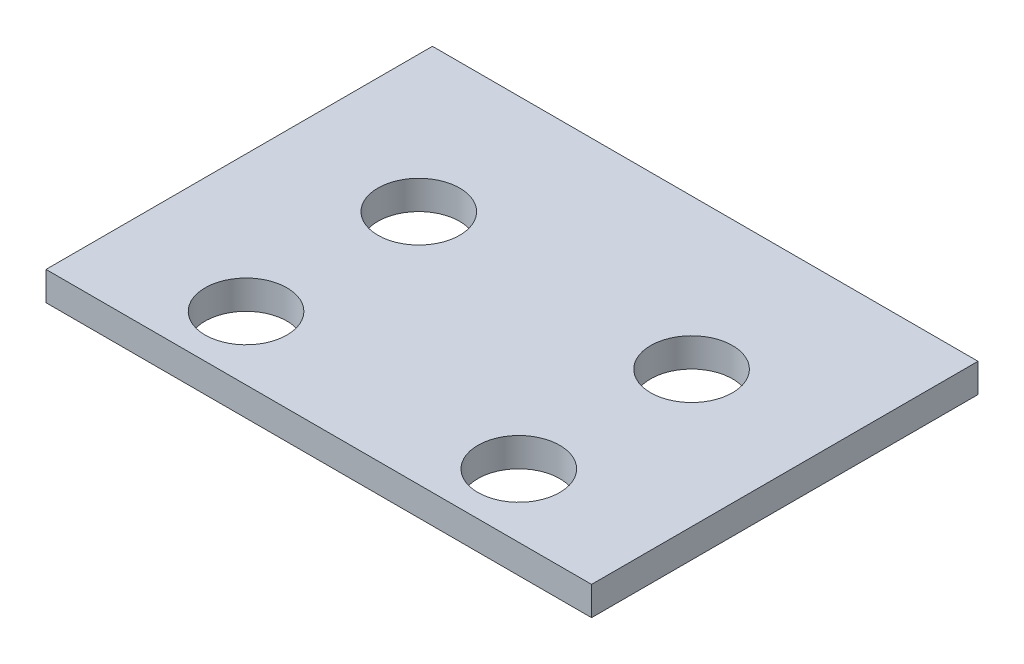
SolidWorks part; units mm, degrees
ref_plane "Front Plane" through (0, 0, 0) normal (0, 0, 1) x (1, 0, 0)
ref_plane "Top Plane" through (0, 0, 0) normal (0, 1, 0) x (1, 0, 0)
ref_plane "Right Plane" through (0, 0, 0) normal (1, 0, 0) x (0, 0, -1)
sketch "Sketch1" plane through (0, 0, 0) normal (0, 1, 0) x (1, 0, 0)
  line L1 (-30, 21.25) -> (30, 21.25)
  line L2 (-30, 21.25) -> (-30, -21.25)
  line L3 (-30, -21.25) -> (30, -21.25)
  line L4 (30, 21.25) -> (30, -21.25)
  line L5 (-30, 21.25) -> (30, -21.25) construction
  line L6 (-30, -21.25) -> (30, 21.25) construction
  point P0 (0, 0)
  dimension "D1" = 60
  dimension "D2" = 42.5
extrude "Extrude1" add sketch "Sketch1" along normal blind 3.175
sketch "Sketch13" plane through (0, 3.175, 0) normal (0, 1, 0) x (1, 0, 0)
  line L0 (-15, -7.4946) -> (-15, -31.5784) construction
  line L1 (-32.8805, -14.25) -> (-8.6861, -14.25) construction
  line L2 (-30, -21.25) -> (30, -21.25) construction
  dimension "D1" = 7
  dimension "D2" = 15
hole_wizard "M8 Clearance Hole4" positions "3DSketch10" profile "Sketch14" hole size "M8" standard "ISO"
sketch3d "3DSketch10"
  line L0 (-15, 3.175, 7.4946) -> (-15, 3.175, 31.5784) construction
  line L1 (-32.8805, 3.175, 14.25) -> (-8.6861, 3.175, 14.25) construction
  point P0 (-15, 3.175, 14.25)
sketch "Sketch14" plane through (-15, 3.175, 14.25) normal (1, 0, 0) x (0, 0, 1)
  line L0 (0, 0) -> (0, 9.0539)
  line L1 (0, 9.0539) -> (4.5, 6.35)
  line L2 (4.5, 6.35) -> (4.5, 0)
  line L5 (4.5, 0) -> (0, 0)
  line L10 (0, 9.0539) -> (-4.5, 6.35) construction
  line L11 (0, -6.35) -> (0, 107.95) construction
  dimension "Hole Dia." = 9
  dimension "Hole Depth" = 6.35
  dimension "Drill Angle" = 118
mirror "Mirror1" about plane through (0, 0, 0) normal (1, 0, 0) of "M8 Clearance Hole4"
pattern_linear "LPattern1" count 2 spacing 19 along (0, 0, -1) of "M8 Clearance Hole4", "Mirror1"
